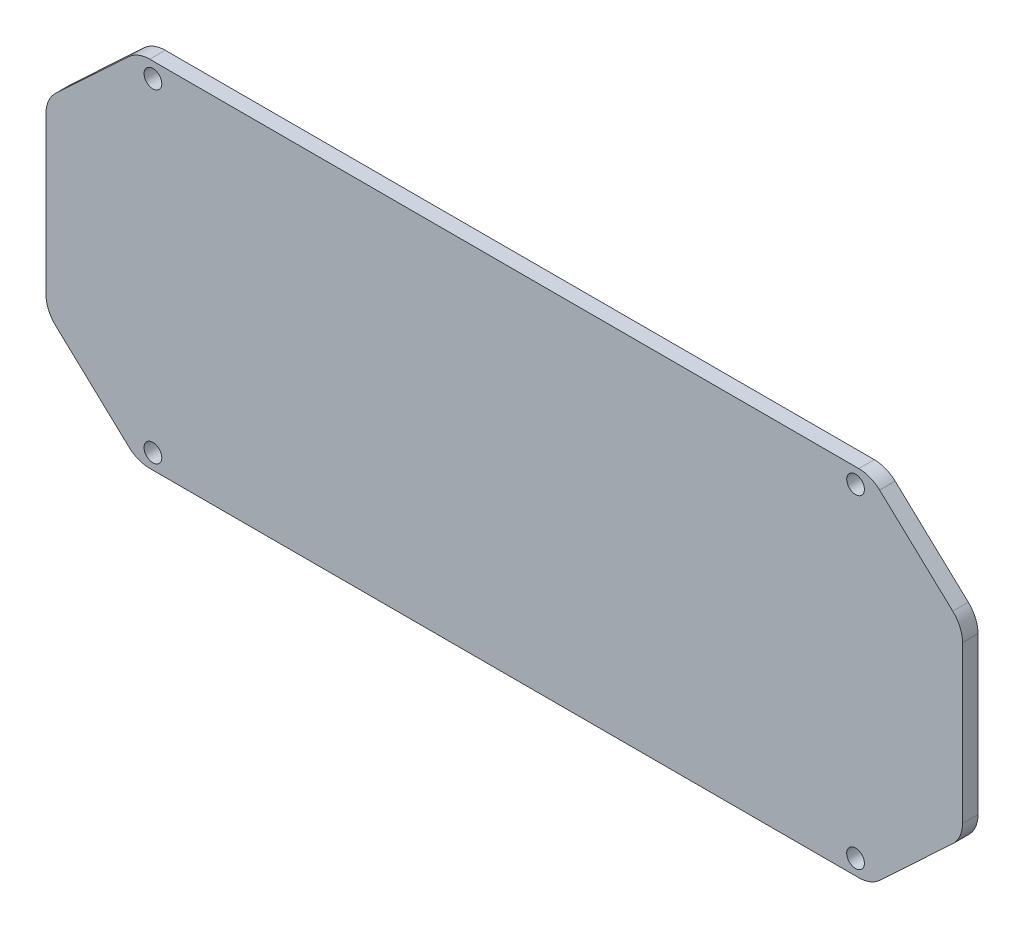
SolidWorks part; units mm, degrees
ref_plane "Front Plane" through (0, 0, 0) normal (0, 0, 1) x (1, 0, 0)
ref_plane "Top Plane" through (0, 0, 0) normal (0, 1, 0) x (1, 0, 0)
ref_plane "Right Plane" through (0, 0, 0) normal (1, 0, 0) x (0, 0, -1)
sketch "Sketch1" plane through (0, 0, 0) normal (0, 0, 1) x (1, 0, 0)
  line L5 (-60, 29) -> (-75, 15)
  line L16 (75, -1.9) -> (75, 15) construction
  line L30 (-60, -29) -> (-60, 29) construction
  line L31 (-60, 29) -> (60, 29)
  line L32 (60, -29) -> (60, 29) construction
  line L33 (-60, -29) -> (60, 29) construction
  line L34 (-60, 29) -> (60, -29) construction
  line L35 (-75, -15) -> (75, -15) construction
  line L36 (-75, -15) -> (-75, 15)
  line L37 (-75, 15) -> (75, 15) construction
  line L38 (75, -15) -> (75, 15)
  line L39 (-75, -15) -> (75, 15) construction
  line L40 (-75, 15) -> (75, -15) construction
  line L42 (60, 29) -> (75, 15)
  line L43 (75, -15) -> (60, -29)
  line L44 (-75, -15) -> (-60, -29)
  line L45 (-60, -29) -> (60, -29)
  circle A0 centre (-57.5, 26.5) radius 1.45
  circle A1 centre (-57.5, -26.5) radius 1.45
  circle A2 centre (57.5, 26.5) radius 1.45
  circle A3 centre (57.5, -26.5) radius 1.45
  point P0 (0, 0)
  point P5 (0, 0)
  point P6 (0, 0)
  point P15 (0, 0)
  dimension "D5" = 58
  dimension "D1" = 30
  dimension "D2" = 120
extrude "Boss-Extrude1" add sketch "Sketch1" along normal blind 2.54
fillet "Fillet1" radius 5 8 edges at (-75, -15, 1.27) (75, -15, 1.27) (75, 15, 1.27) (-75, 15, 1.27) (60, -29, 1.27) (-60, -29, 1.27) (60, 29, 1.27) (-60, 29, 1.27)
hole_wizard "M2x0.4 Tapped Hole1" positions "Sketch4" profile "Sketch3" tap size "M2x0.4" standard "ANSI Metric"
sketch "Sketch4" plane through (0, 0, 0) normal (0, 0, -1) x (-1, 0, 0)
  point P0 (-71.7459, 0)
  point P2 (-50.7459, 0)
  point P4 (-50.7459, 12.5)
  point P6 (-71.7459, 12.5)
  dimension "D1" = 12.5
  dimension "D2" = 12.5
  dimension "D3" = 21
sketch "Sketch3" plane through (71.7459, 0, 0) normal (1, 0, 0) x (0, 1, 0)
  line L0 (0, 0) -> (0, 6.4807)
  line L1 (0, 6.4807) -> (0.8, 6)
  line L2 (0.8, 6) -> (0.8, 0)
  line L5 (0.8, 0) -> (0, 0)
  line L10 (0, 6.4807) -> (-0.8, 6) construction
  line L11 (0, -6.35) -> (0, 107.95) construction
  dimension "Tap Drill Dia." = 1.6
  dimension "Tap Drill Depth" = 6
  dimension "Drill Angle" = 118
mirror "Mirror1" about plane through (0, 0, 0) normal (1, 0, 0)
hole_wizard "M2x0.4 Tapped Hole2" positions "Sketch5" profile "Sketch6" tap size "M2x0.4" standard "ANSI Metric"
sketch "Sketch5" plane through (0, 0, 0) normal (0, 0, -1) x (-1, 0, 0)
  point P0 (10.5, 0)
  point P2 (10.5, 12.5)
  point P4 (-10.5, 12.5)
  point P6 (-10.5, 0)
  dimension "D1" = 21
  dimension "D2" = 21
  dimension "D3" = 10.5
  dimension "D4" = 12.5
sketch "Sketch6" plane through (-10.5, 0, 0) normal (1, 0, 0) x (0, 1, 0)
  line L0 (0, 0) -> (0, 6.4807)
  line L1 (0, 6.4807) -> (0.8, 6)
  line L2 (0.8, 6) -> (0.8, 0)
  line L5 (0.8, 0) -> (0, 0)
  line L10 (0, 6.4807) -> (-0.8, 6) construction
  line L11 (0, -6.35) -> (0, 107.95) construction
  dimension "Tap Drill Dia." = 1.6
  dimension "Tap Drill Depth" = 6
  dimension "Drill Angle" = 118
